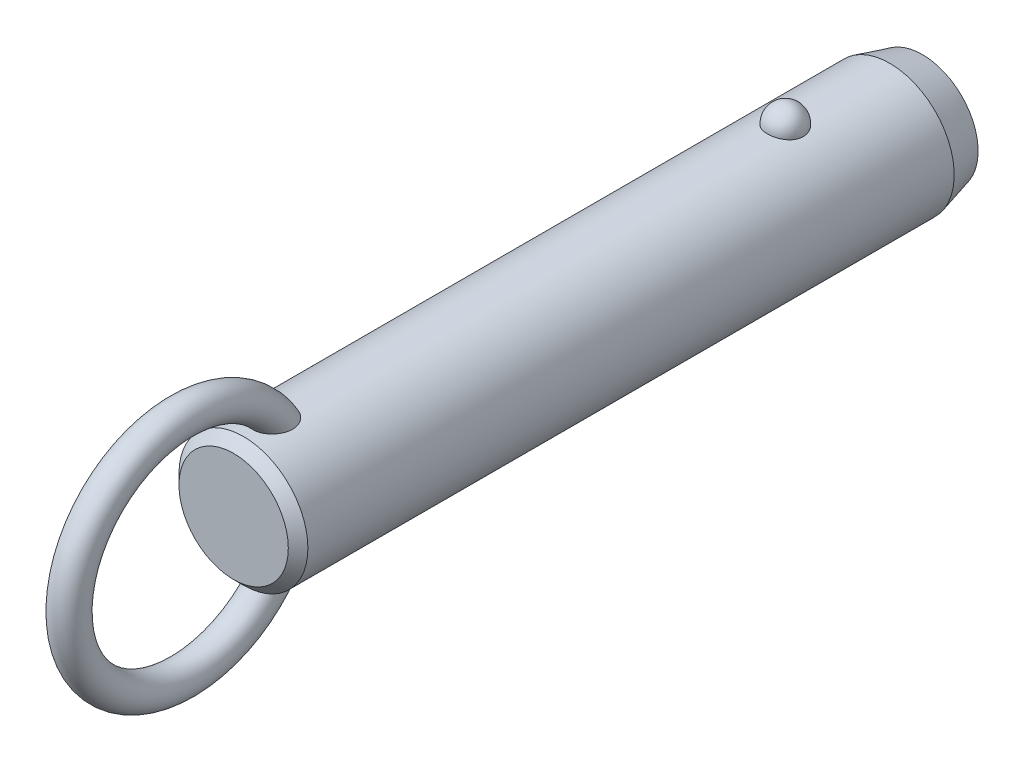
SolidWorks part; units mm, degrees
ref_plane "Front Plane" through (0, 0, 0) normal (0, 0, 1) x (1, 0, 0)
ref_plane "Top Plane" through (0, 0, 0) normal (0, 1, 0) x (1, 0, 0)
ref_plane "Right Plane" through (0, 0, 0) normal (1, 0, 0) x (0, 0, -1)
sketch "Sketch2" plane through (0, 0, 0) normal (0, 0, 1) x (1, 0, 0)
  circle A0 centre (0, 0) radius 7.9
  point P3 (0, 7.9)
  dimension "D1" = 15.8
extrude "Boss-Extrude1" add sketch "Sketch2" along normal blind 55.9
sketch "Sketch3" plane through (0, 0, 0) normal (0, 0, -1) x (-1, 0, 0)
  circle A0 centre (0, 0) radius 7.9
  dimension "D1" = 15.8
extrude "Boss-Extrude2" add sketch "Sketch3" along normal blind 19
chamfer "Chamfer1" distance 4 angle 15 1 edges at (-7.9, 0, -19)
sketch "Sketch12" plane through (0, 0, 0) normal (1, 0, 0) x (0, 0, -1)
  line L0 (-55.9, 7.9) -> (-55.9, -7.9) construction
  point P0 (-55.9, 0)
sketch "Sketch13" plane through (0, 0, 0) normal (1, 0, 0) x (0, 0, -1)
  circle A0 centre (-71.75, 0) radius 15.85
  point P2 (-55.9, 0)
  dimension "D1" = 31.7
sketch "Sketch14" plane through (0, 0, 0) normal (0, 1, 0) x (1, 0, 0)
  circle A0 centre (0, -57.9) radius 2
  point P2 (0, -55.9)
  dimension "D1" = 4
sweep "Sweep1" add profiles "Sketch14" path "Sketch13"
sketch "Sketch15" plane through (0, 0, 55.9) normal (0, 0, 1) x (1, 0, 0)
  circle A0 centre (0, 0) radius 7.9
  dimension "D1" = 15.8
extrude "Boss-Extrude3" add sketch "Sketch15" along normal blind 9.52
chamfer "Chamfer2" distance 1.2 angle 45 1 edges at (7.9, 0, 65.42)
sketch "Sketch18" plane through (0, 0, 0) normal (1, 0, 0) x (0, 0, -1)
  line L0 (15, 7.9) -> (-58.0091, 7.9) construction
  line L1 (2.2, 10.1) -> (2.2, 5.7)
  line L2 (-58.0091, -7.9) -> (15, -7.9) construction
  arc A0 (2.2, 10.1) -> (2.2, 5.7) centre (2.2, 7.9) ccw
  point P4 (0, 7.9)
  dimension "D1" = 18
revolve "Revolve1" add sketch "Sketch18" angle 360 about L1
